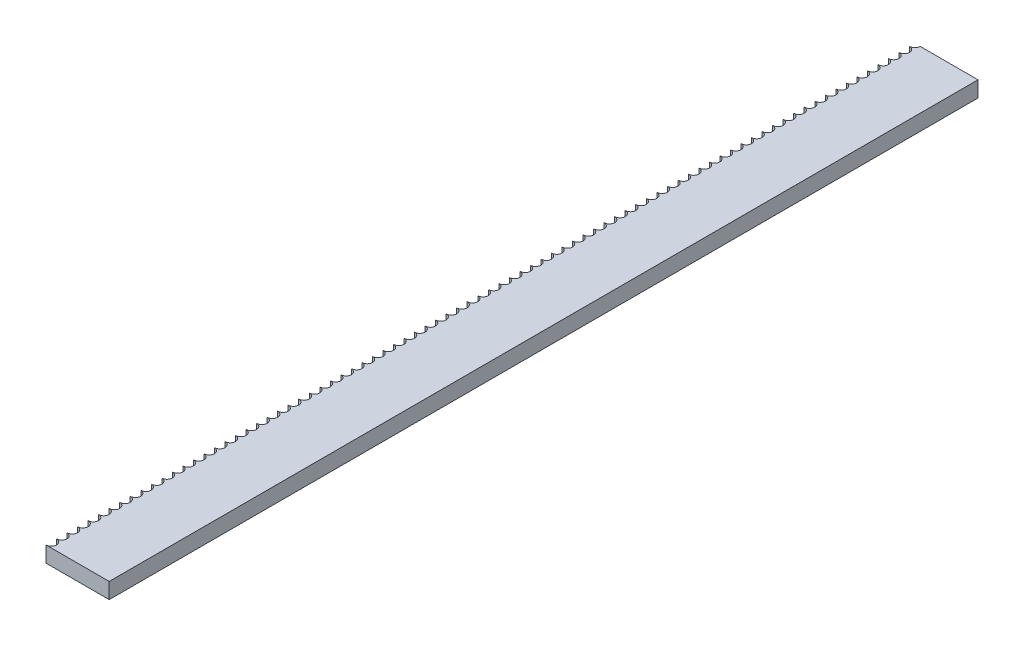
SolidWorks part; units mm, degrees
ref_plane "Front Plane" through (0, 0, 0) normal (0, 0, 1) x (1, 0, 0)
ref_plane "Top Plane" through (0, 0, 0) normal (0, 1, 0) x (1, 0, 0)
ref_plane "Right Plane" through (0, 0, 0) normal (1, 0, 0) x (0, 0, -1)
sketch "Sketch1" plane through (0, 0, 0) normal (0, 1, 0) x (1, 0, 0)
  line L1 (-6, 82.5) -> (6, 82.5)
  line L2 (-6, 82.5) -> (-6, -82.5)
  line L3 (-6, -82.5) -> (6, -82.5)
  line L4 (6, 82.5) -> (6, -82.5)
  line L5 (-6, 82.5) -> (6, -82.5) construction
  line L6 (-6, -82.5) -> (6, 82.5) construction
  point P0 (0, 0)
  dimension "D1" = 12
  dimension "D2" = 165
extrude "Boss-Extrude1" add sketch "Sketch1" along normal blind 3
sketch "Sketch2" plane through (0, 3, 0) normal (0, 1, 0) x (1, 0, 0)
  line L0 (-6, 82.5) -> (-6, -82.5) construction
  arc A0 (-6, -82.5) -> (-6, -80.5) centre (-6, -81.5) ccw
  dimension "D1" = 1
extrude "Cut-Extrude1" cut sketch "Sketch2" against normal through all and the other way through all
pattern_linear "LPattern1" count 100 spacing 2 along (0, 0, -1) of "Cut-Extrude1"
